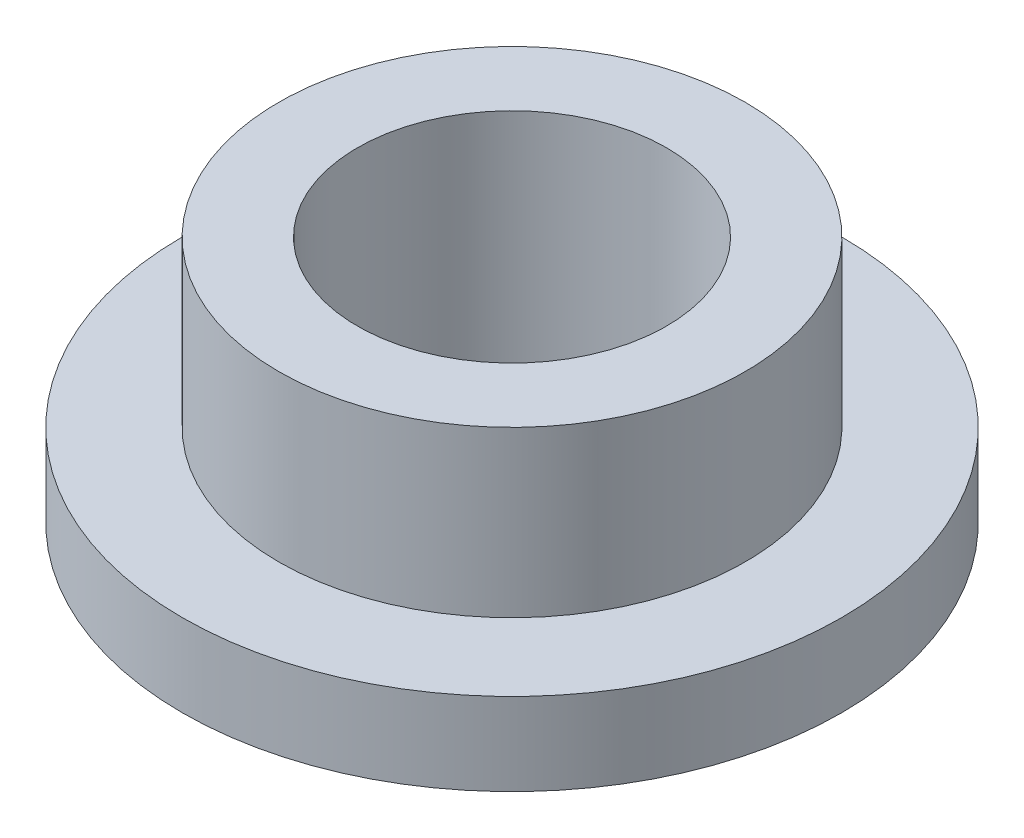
SolidWorks part; units mm, degrees
ref_plane "Front Plane" through (0, 0, 0) normal (0, 0, 1) x (1, 0, 0)
ref_plane "Top Plane" through (0, 0, 0) normal (0, 1, 0) x (1, 0, 0)
ref_plane "Right Plane" through (0, 0, 0) normal (1, 0, 0) x (0, 0, -1)
sketch "Sketch1" plane through (0, 0, 0) normal (0, 0, 1) x (1, 0, 0)
  line L0 (0, 0) -> (0, 20.4301) construction
  line L1 (2.3813, 0) -> (5.08, 0)
  line L2 (5.08, 0) -> (5.08, 1.27)
  line L3 (5.08, 1.27) -> (3.5941, 1.27)
  line L4 (3.5941, 1.27) -> (3.5941, 3.81)
  line L5 (3.5941, 3.81) -> (2.3813, 3.81)
  line L6 (2.3813, 3.81) -> (2.3813, 0)
  dimension "D1" = 4.7625
  dimension "D2" = 7.1882
  dimension "D3" = 1.27
  dimension "D4" = 10.16
  dimension "D5" = 2.54
revolve "Revolve1" add sketch "Sketch1" angle 360 about L0
